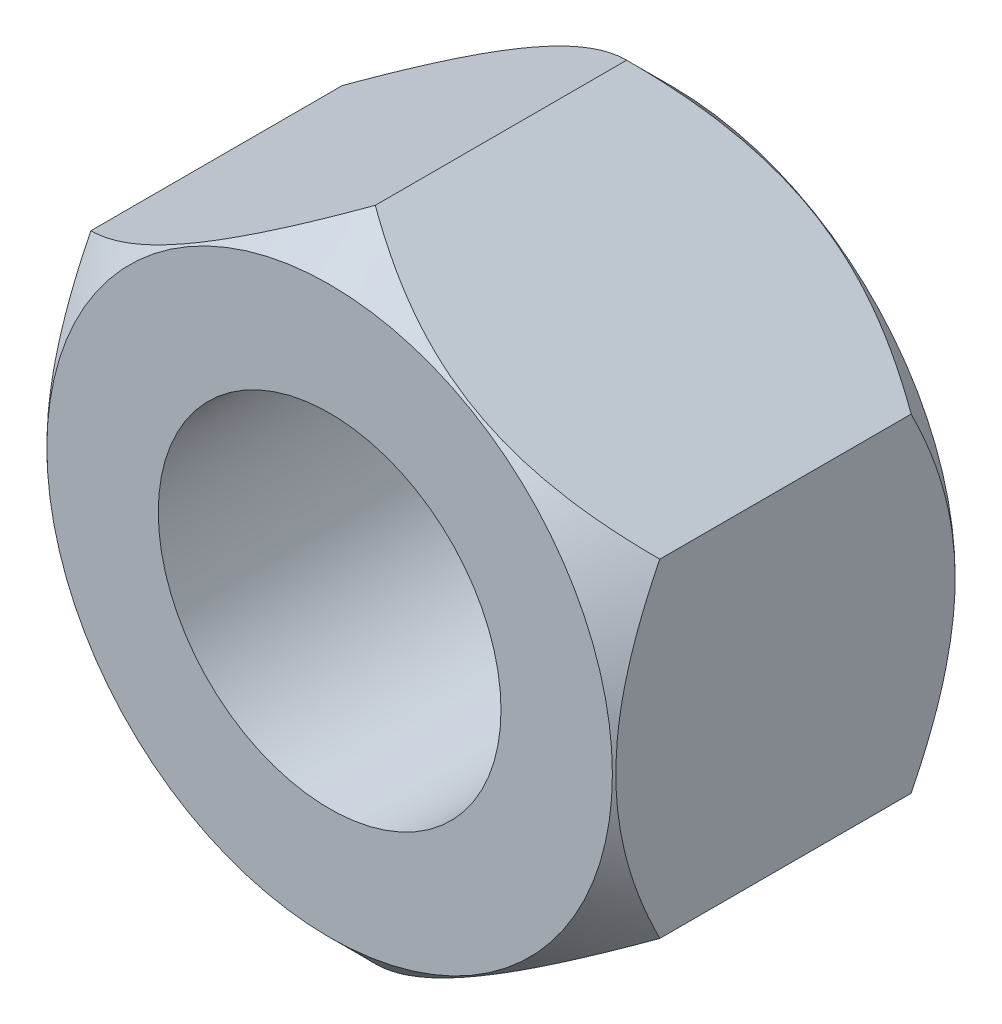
SolidWorks part; units mm, degrees
ref_plane "Плоскость1" through (0, 0, 0) normal (0, 0, 1) x (1, 0, 0)
ref_plane "Плоскость2" through (0, 0, 0) normal (0, 1, 0) x (1, 0, 0)
ref_plane "Плоскость3" through (0, 0, 0) normal (1, 0, 0) x (0, 0, -1)
sketch "Эскиз1" plane through (0, 0, 0) normal (0, 0, 1) x (1, 0, 0)
  circle A0 centre (0, 0) radius 3
  circle A1 centre (0, 0) radius 5.75
  dimension "D1" = 11.5
  dimension "D2" = 6
extrude "Основание-Вытянуть" add sketch "Эскиз1" along normal blind 6
chamfer "Фаска1" distance 0.8 angle 45 1 edges at (5.75, 0, 6)
chamfer "Фаска2" distance 0.8 angle 45 1 edges at (5.75, 0, 0)
sketch "Эскиз2" plane through (0, 0, 6) normal (0, 0, 1) x (1, 0, 0)
  line L1 (4.9796, 2.875) -> (0, 5.75)
  line L2 (0, 5.75) -> (-4.9796, 2.875)
  line L3 (-4.9796, 2.875) -> (-4.9796, -2.875)
  line L4 (-4.9796, -2.875) -> (0, -5.75)
  line L5 (0, -5.75) -> (4.9796, -2.875)
  line L6 (4.9796, -2.875) -> (4.9796, 2.875)
  circle A0 centre (0, 0) radius 4.9796 construction
  circle A1 centre (0, 0) radius 6.3437
  circle A2 centre (0, 0) radius 5.75 construction
extrude "Вырез-Вытянуть1" cut sketch "Эскиз2" against normal through all
